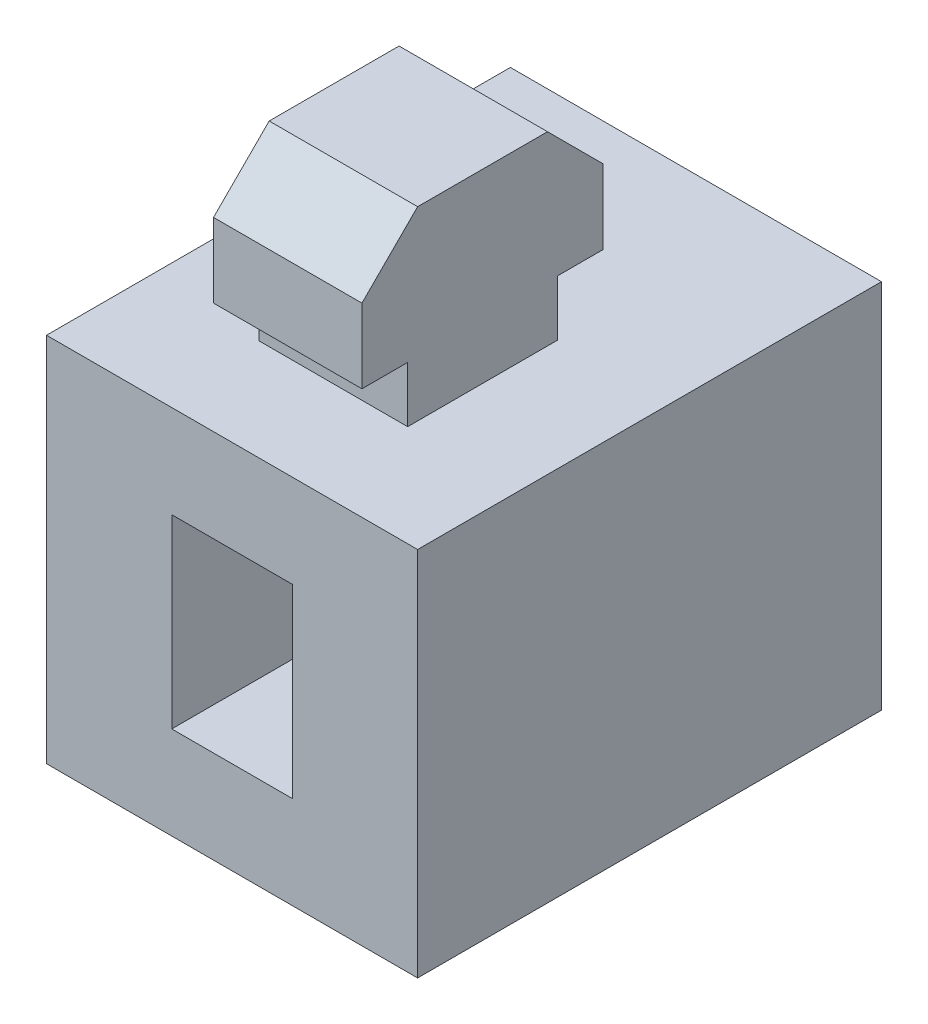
SolidWorks part; units mm, degrees
ref_plane "前视基准面" through (0, 0, 0) normal (0, 0, 1) x (1, 0, 0)
ref_plane "上视基准面" through (0, 0, 0) normal (0, 1, 0) x (1, 0, 0)
ref_plane "右视基准面" through (0, 0, 0) normal (1, 0, 0) x (0, 0, -1)
sketch "草图1" plane through (0, 0, 0) normal (0, 0, 1) x (1, 0, 0)
  line L1 (-10, 10) -> (10, 10)
  line L2 (-10, 10) -> (-10, -10)
  line L3 (-10, -10) -> (10, -10)
  line L4 (10, 10) -> (10, -10)
  line L5 (-3.25, 5) -> (3.25, 5)
  line L6 (-3.25, 5) -> (-3.25, -5)
  line L7 (-3.25, -5) -> (3.25, -5)
  line L8 (3.25, 5) -> (3.25, -5)
  dimension "D1" = 20
  dimension "D2" = 20
  dimension "D3" = 10
  dimension "D4" = 10
  dimension "D5" = 6.5
  dimension "D6" = 10
  dimension "D7" = 5
  dimension "D8" = 3.25
extrude "凸台-拉伸1" add sketch "草图1" along normal mid plane 25
sketch "草图2" plane through (0, -10, 0) normal (0, -1, 0) x (1, 0, 0)
  line L0 (-10, 12.5) -> (10, 12.5) construction
  line L1 (-5, 5.5) -> (5, 5.5)
  line L2 (-5, 5.5) -> (-5, 0.5)
  line L3 (-5, 0.5) -> (5, 0.5)
  line L4 (5, 5.5) -> (5, 0.5)
  dimension "D1" = 10
  dimension "D2" = 5
  dimension "D3" = 5
  dimension "D4" = 7
extrude "切除-拉伸1" cut sketch "草图2" against normal blind 17
sketch "草图4" plane through (0, 10, 0) normal (0, 1, 0) x (1, 0, 0)
  line L0 (10, -12.5) -> (-10, -12.5) construction
  line L1 (-4, 3.5) -> (4, 3.5)
  line L2 (-4, 3.5) -> (-4, -9.5)
  line L3 (-4, -9.5) -> (4, -9.5)
  line L4 (4, 3.5) -> (4, -9.5)
  dimension "D1" = 8
  dimension "D2" = 13
  dimension "D3" = 4
  dimension "D4" = 3
extrude "凸台-拉伸2" add sketch "草图4" along normal blind 10
sketch "草图5" plane through (4, 0, 0) normal (1, 0, 0) x (0, 0, -1)
  line L0 (-12.5, 10) -> (12.5, 10) construction
  line L1 (3.5359, 10) -> (1.0359, 10)
  line L2 (3.5359, 10) -> (3.5359, 13)
  line L3 (3.5359, 13) -> (1.0359, 13)
  line L4 (1.0359, 10) -> (1.0359, 13)
  dimension "D1" = 3
  dimension "D2" = 2.5
extrude "切除-拉伸2" cut sketch "草图5" against normal through all
ref_plane "基准面1" through (0, 0, 3) normal (0, 0, 1) x (1, 0, 0)
mirror "镜向1" about plane through (0, 0, 3) normal (0, 0, 1) of "切除-拉伸2"
sketch "草图6" plane through (4, 0, 0) normal (1, 0, 0) x (0, 0, -1)
  line L0 (3.5, 17) -> (3.5, 20)
  line L1 (3.5, 20) -> (3.5, 13) construction
  line L2 (3.5, 20) -> (0.5, 20)
  line L3 (-9.5, 20) -> (3.5, 20) construction
  line L4 (0.5, 20) -> (3.5, 17)
  dimension "D1" = 3
  dimension "D2" = 3
extrude "切除-拉伸3" cut sketch "草图6" against normal through all
mirror "镜向2" about plane through (0, 0, 3) normal (0, 0, 1) of "切除-拉伸3"
